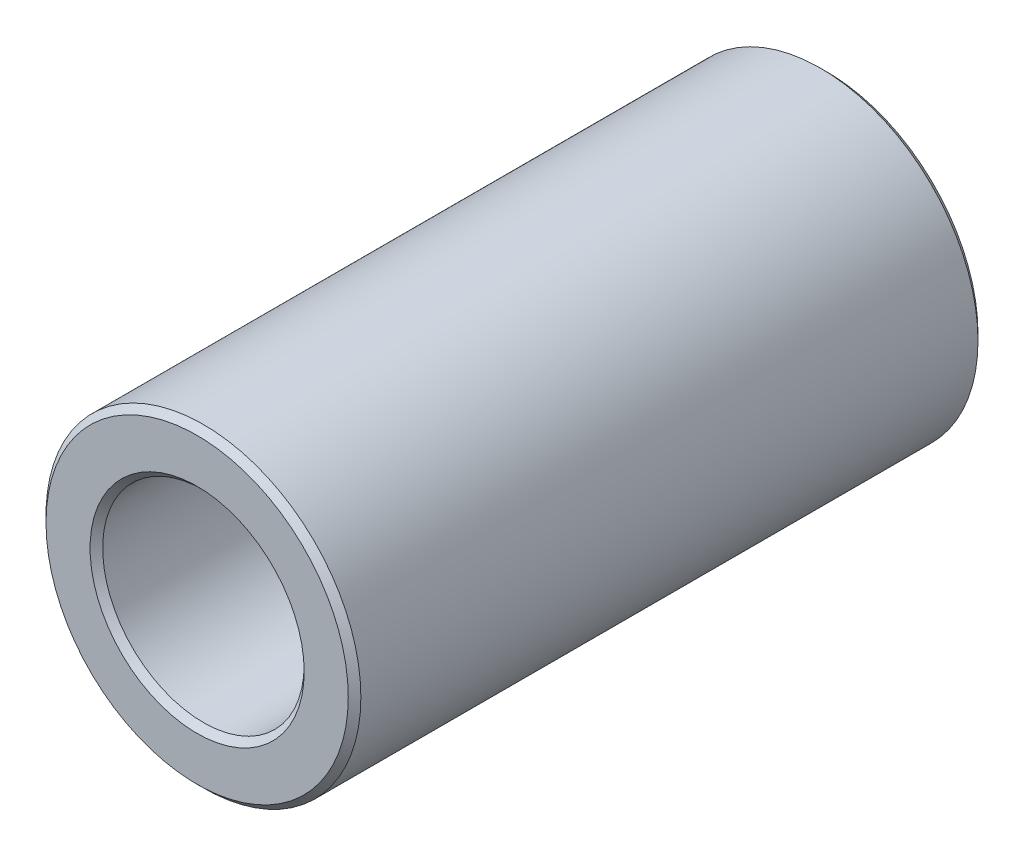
SolidWorks part; units mm, degrees
ref_plane "Front Plane" through (0, 0, 0) normal (0, 0, 1) x (1, 0, 0)
ref_plane "Top Plane" through (0, 0, 0) normal (0, 1, 0) x (1, 0, 0)
ref_plane "Right Plane" through (0, 0, 0) normal (1, 0, 0) x (0, 0, -1)
sketch "Sketch1" plane through (0, 0, 0) normal (0, 0, 1) x (1, 0, 0)
  circle A0 centre (0, 0) radius 5
  circle A1 centre (0, 0) radius 3.2
  dimension "D1" = 10
  dimension "D2" = 6.4
extrude "Boss-Extrude2" add sketch "Sketch1" along normal mid plane 20
chamfer "Chamfer3" distance 0.2 angle 45 4 edges at (5, 0, 10) (5, 0, -10) (3.2, 0, -10) (3.2, 0, 10)
